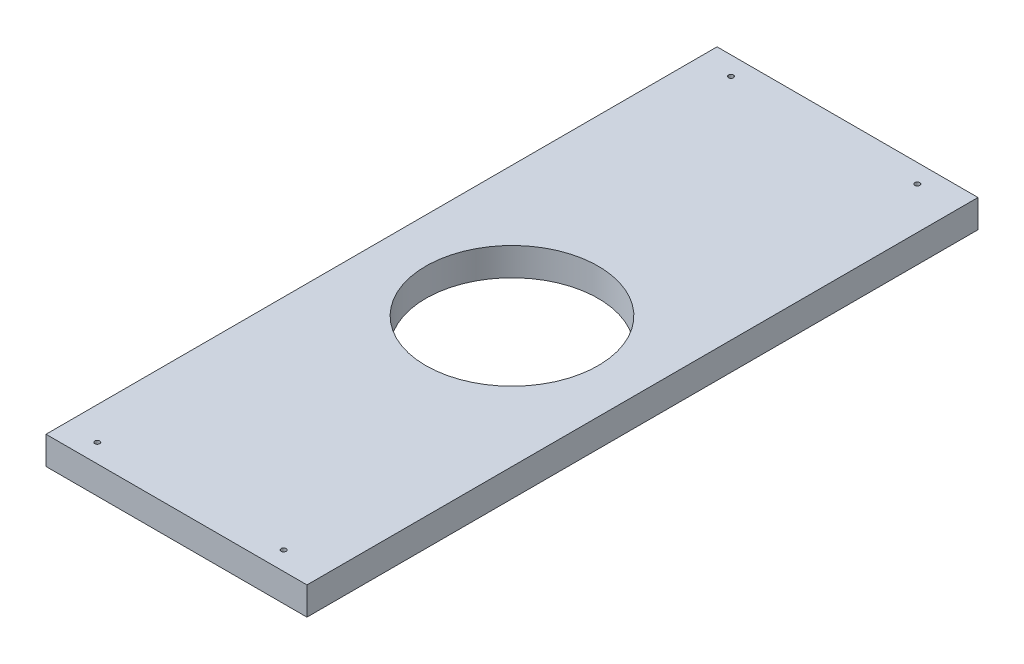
SolidWorks part; units mm, degrees
ref_plane "Front Plane" through (0, 0, 0) normal (0, 0, 1) x (1, 0, 0)
ref_plane "Top Plane" through (0, 0, 0) normal (0, 1, 0) x (1, 0, 0)
ref_plane "Right Plane" through (0, 0, 0) normal (1, 0, 0) x (0, 0, -1)
sketch "Sketch1" plane through (0, 0, 0) normal (0, 1, 0) x (1, 0, 0)
  line L1 (-177.8, -457.2) -> (177.8, -457.2)
  line L2 (-177.8, -457.2) -> (-177.8, 457.2)
  line L3 (-177.8, 457.2) -> (177.8, 457.2)
  line L4 (177.8, -457.2) -> (177.8, 457.2)
  dimension "D1" = 914.4
  dimension "D2" = 457.2
  dimension "D3" = 355.6
  dimension "D4" = 177.8
extrude "Boss-Extrude1" add sketch "Sketch1" against normal blind 38.1
sketch "Sketch2" plane through (0, 0, 0) normal (0, 1, 0) x (1, 0, 0)
  circle A0 centre (0, 0) radius 117.475
  dimension "D1" = 234.95
extrude "Cut-Extrude1" cut sketch "Sketch2" against normal through all
hole_wizard "1/4 Clearance Hole1" positions "Sketch4" profile "Sketch3" hole size "1/4" standard "ANSI Inch"
sketch "Sketch4" plane through (0, 0, 0) normal (0, 1, 0) x (1, 0, 0)
  line L0 (-177.8, -457.2) -> (177.8, -457.2) construction
  line L1 (0, 0) -> (-419.141, 0) construction
  line L3 (177.8, -457.2) -> (177.8, 457.2) construction
  line L4 (-177.8, 457.2) -> (-177.8, -457.2) construction
  point P0 (-133.35, -431.8)
  point P11 (120.65, -431.8)
  point P16 (-133.35, 431.8)
  point P17 (120.65, 431.8)
  dimension "D1" = 25.4
  dimension "D2" = 57.15
  dimension "D3" = 254
  dimension "D4" = 44.45
sketch "Sketch3" plane through (-133.35, 0, 431.8) normal (1, 0, 0) x (0, 0, 1)
  line L0 (0, 0) -> (0, 38.1)
  line L1 (0, 38.1) -> (3.3782, 38.1)
  line L2 (3.3782, 38.1) -> (3.3782, 0)
  line L5 (3.3782, 0) -> (0, 0)
  line L11 (0, -6.35) -> (0, 107.95) construction
  dimension "Thru Hole Dia." = 6.7564
  dimension "Thru Hole Depth" = 38.1
